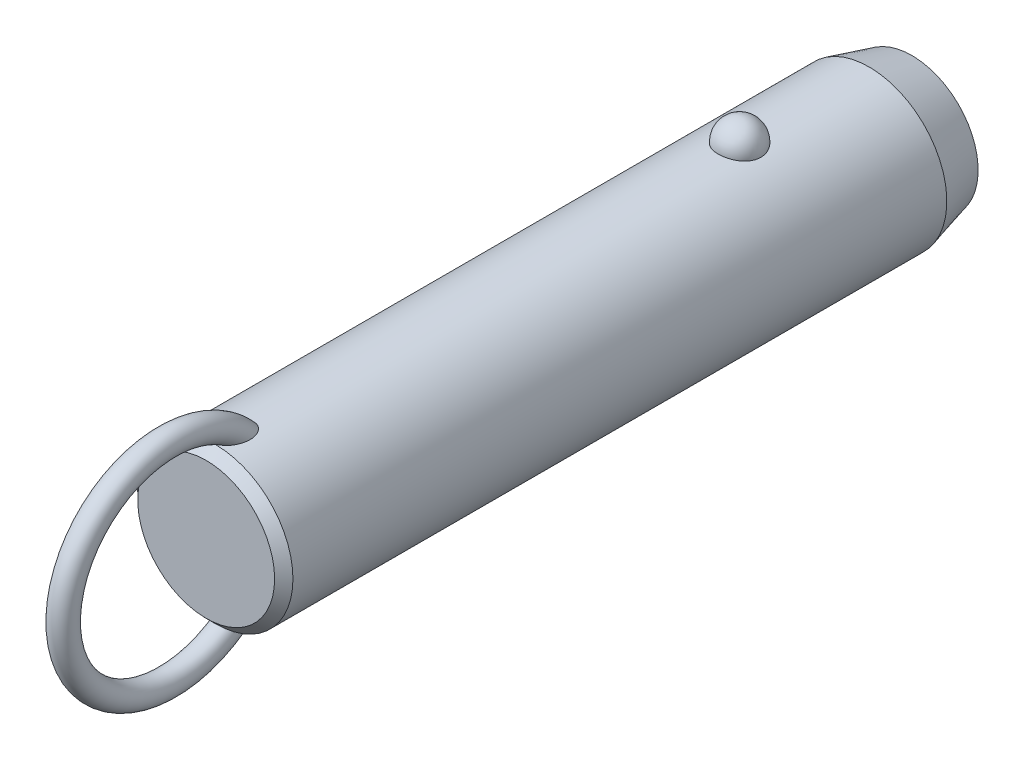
SolidWorks part; units mm, degrees
ref_plane "Front Plane" through (0, 0, 0) normal (0, 0, 1) x (1, 0, 0)
ref_plane "Top Plane" through (0, 0, 0) normal (0, 1, 0) x (1, 0, 0)
ref_plane "Right Plane" through (0, 0, 0) normal (1, 0, 0) x (0, 0, -1)
sketch "Sketch2" plane through (0, 0, 0) normal (0, 0, 1) x (1, 0, 0)
  circle A0 centre (0, 0) radius 12.7
  point P3 (0, 12.7)
  dimension "D1" = 25.4
extrude "Boss-Extrude1" add sketch "Sketch2" along normal blind 71.1
sketch "Sketch3" plane through (0, 0, 0) normal (0, 0, -1) x (-1, 0, 0)
  circle A0 centre (0, 0) radius 12.7
  dimension "D1" = 25.4
extrude "Boss-Extrude2" add sketch "Sketch3" along normal blind 31.7
chamfer "Chamfer1" distance 7 angle 15 1 edges at (-12.7, 0, -31.7)
sketch "Sketch12" plane through (0, 0, 0) normal (1, 0, 0) x (0, 0, -1)
  line L0 (-71.1, 12.7) -> (-71.1, -12.7) construction
  point P0 (-71.1, 0)
sketch "Sketch13" plane through (0, 0, 0) normal (1, 0, 0) x (0, 0, -1)
  circle A0 centre (-90.15, 0) radius 19.05
  point P2 (-71.1, 0)
  dimension "D1" = 38.1
sketch "Sketch14" plane through (0, 0, 0) normal (0, 1, 0) x (1, 0, 0)
  circle A0 centre (0, -73.1) radius 2
  point P2 (0, -71.1)
  dimension "D1" = 4
sweep "Sweep1" add profiles "Sketch14" path "Sketch13"
sketch "Sketch15" plane through (0, 0, 71.1) normal (0, 0, 1) x (1, 0, 0)
  circle A0 centre (0, 0) radius 12.7
  dimension "D1" = 25.4
extrude "Boss-Extrude3" add sketch "Sketch15" along normal blind 12.7
chamfer "Chamfer2" distance 1.5 angle 45 1 edges at (12.7, 0, 83.8)
sketch "Sketch18" plane through (0, 0, 0) normal (1, 0, 0) x (0, 0, -1)
  line L0 (24.7, 12.7) -> (-75.951, 12.7) construction
  line L1 (3.5, 16.2) -> (3.5, 9.2)
  line L2 (-75.951, -12.7) -> (24.7, -12.7) construction
  arc A0 (3.5, 16.2) -> (3.5, 9.2) centre (3.5, 12.7) ccw
  point P4 (0, 12.7)
  dimension "D1" = 28.9
revolve "Revolve1" add sketch "Sketch18" angle 360 about L1
